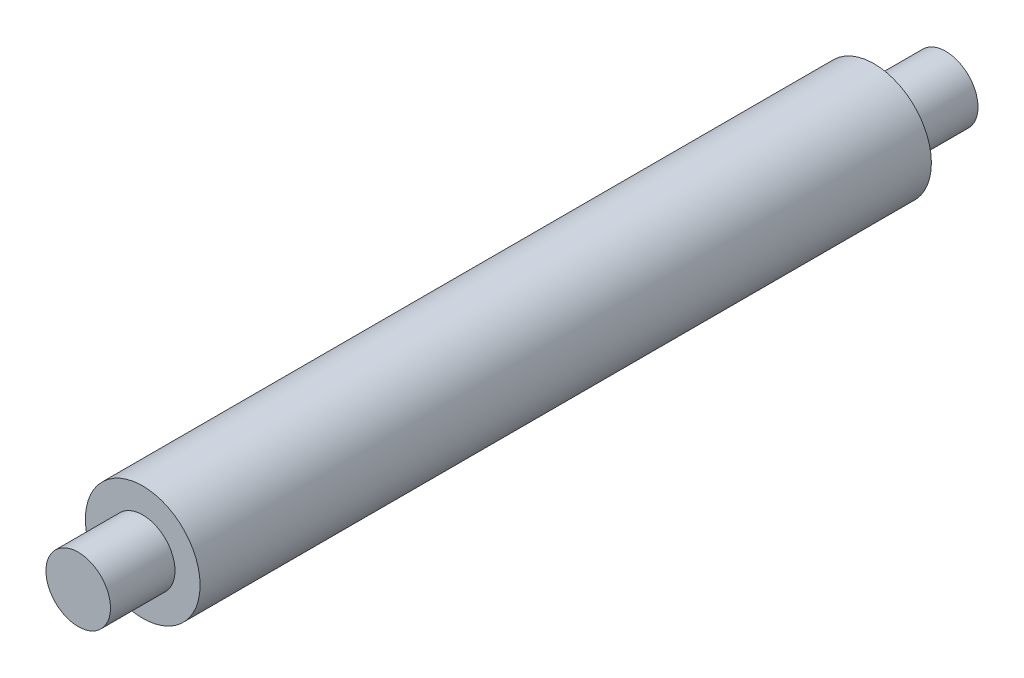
SolidWorks part; units mm, degrees
ref_plane "Front Plane" through (0, 0, 0) normal (0, 0, 1) x (1, 0, 0)
ref_plane "Top Plane" through (0, 0, 0) normal (0, 1, 0) x (1, 0, 0)
ref_plane "Right Plane" through (0, 0, 0) normal (1, 0, 0) x (0, 0, -1)
sketch "Croquis1" plane through (0, 0, 0) normal (0, 0, 1) x (1, 0, 0)
  circle A0 centre (0, 0) radius 8
  dimension "D1" = 16
extrude "Saliente-Extruir1" add sketch "Croquis1" along normal blind 102
sketch "Croquis2" plane through (0, 0, 102) normal (0, 0, 1) x (1, 0, 0)
  circle A0 centre (0, 0) radius 4.5
  dimension "D1" = 9
extrude "Saliente-Extruir2" add sketch "Croquis2" along normal blind 9 and the other way blind 112
